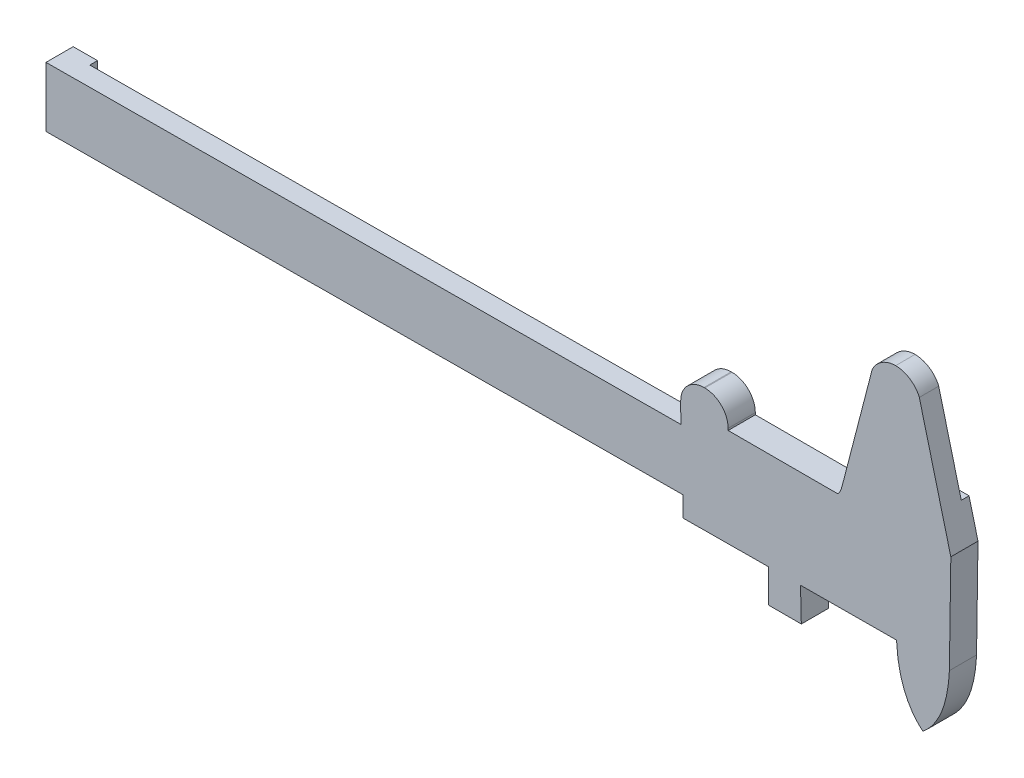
SolidWorks part; units mm, degrees
ref_plane "Front" through (0, 0, 0) normal (0, 0, 1) x (1, 0, 0)
ref_plane "Top" through (0, 0, 0) normal (0, 1, 0) x (1, 0, 0)
ref_plane "Right" through (0, 0, 0) normal (1, 0, 0) x (0, 0, -1)
sketch "Esquisse1" plane through (0, 0, 0) normal (0, 0, 1) x (1, 0, 0)
  line L0 (56.9792, 37.5298) -> (218.1204, -15.4507) construction
  line L1 (0, 0) -> (297.3533, 0) construction
  line L2 (228.6397, 13.6425) -> (203.9081, 13.5241)
  line L3 (204.1175, 4.9655) -> (203.9081, 13.5241)
  line L4 (195.6262, 13.5156) -> (173.6397, 13.3669)
  line L5 (173.6397, 13.3669) -> (173.6397, 18.5659)
  line L6 (173.6397, 18.5659) -> (9.5377, 17.5648)
  line L7 (9.5377, 17.5648) -> (9.5377, 32.987)
  line L8 (9.5377, 32.987) -> (173.0748, 33.9846)
  line L9 (173.0748, 33.9846) -> (173.0064, 45.204)
  line L10 (173.0064, 45.204) -> (185.2667, 45.204)
  line L11 (185.2667, 45.204) -> (185.2667, 38.7229)
  line L12 (185.2667, 38.7229) -> (213.4789, 38.7229)
  line L13 (222.3354, 70.7304) -> (214.6774, 41.1858)
  line L14 (234.5151, 70.7304) -> (242.6343, 39.222)
  line L15 (242.6343, 39.222) -> (242.2593, 13.6425)
  line L16 (195.6262, 13.5156) -> (195.684, 4.9655)
  line L17 (195.684, 4.9655) -> (204.1175, 4.9655)
  line L18 (235.4495, 0.7286) -> (235.4495, 10.8165) construction
  line L19 (228.4253, 47.123) -> (228.4253, 63.9571) construction
  spline S0 degree 3 poles (228.6397, 13.6425) (228.9453, 7.5007) (230.4483, 0.8489) (235.4495, -3.3066) knots 0 0 0 0 1 1 1 1
  spline S1 degree 3 poles (242.2593, 13.6425) (241.9537, 7.5007) (240.4508, 0.8489) (235.4495, -3.3066) knots 0 0 0 0 1 1 1 1
  spline S2 degree 3 poles (222.3354, 70.7304) (223.2655, 73.1065) (225.8348, 74.7747) (228.4253, 74.7747) knots 0 0 0 0 1 1 1 1
  spline S3 degree 3 poles (234.5151, 70.7304) (233.5851, 73.1065) (231.0157, 74.7747) (228.4253, 74.7747) knots 0 0 0 0 1 1 1 1
  spline S4 degree 3 poles (213.4789, 38.7229) (214.2306, 39.406) (214.4393, 40.2671) (214.6774, 41.1858) knots 0 0 0 0 1 1 1 1
  point P20 (9.5377, 32.0225)
  dimension "D1" = 55
extrude "Boss.-Extru.1" add sketch "Esquisse1" along normal blind 7
fillet "Congé1" radius 6 2 edges at (173.0064, 45.204, 3.5) (185.2667, 45.204, 3.5)
sketch "Esquisse2" plane through (0, 0, 0) normal (0, 0, -1) x (-1, 0, 0)
  line L0 (-173.6397, 18.5659) -> (-173.0748, 33.9846)
  line L1 (-173.0748, 33.9846) -> (-15.8212, 33.0253)
  line L2 (-173.0748, 33.9846) -> (-9.5377, 32.987) construction
  line L3 (-15.8212, 33.0253) -> (-15.8212, 17.6032)
  line L4 (-9.5377, 17.5648) -> (-173.6397, 18.5659) construction
  line L5 (-15.8212, 17.6032) -> (-173.6397, 18.5659)
extrude "Enlèv. mat.-Extru.1" cut sketch "Esquisse2" against normal blind 2
sketch "Esquisse3" plane through (0, 0, 0) normal (0, 0, -1) x (-1, 0, 0)
  line L0 (-222.3354, 70.7304) -> (-214.6774, 41.1858) construction
  line L1 (-242.6343, 39.222) -> (-234.5151, 70.7304) construction
  line L2 (-222.3354, 70.7304) -> (-216.4912, 48.1835)
  line L3 (-240.3251, 48.1835) -> (-234.5151, 70.7304)
  line L4 (-240.3251, 48.1835) -> (-216.4912, 48.1835)
  spline S0 degree 3 poles (1990.7209, -1934.1177) (-2748.921, 1801.3548) (2500.9731, -1312.7001) (-3047.9717, 1059.1673) knots -11.267498 -11.267498 -11.267498 -11.267498 12.153158 12.153158 12.153158 12.153158 only from (-228.4253, 74.7747) to (-222.3354, 70.7304) construction
  spline S1 degree 3 poles (2591.2079, 1059.2044) (-2957.8743, -1312.7309) (2292.0875, 1801.3698) (-2447.5611, -1934.1095) knots -11.15328 -11.15328 -11.15328 -11.15328 12.267481 12.267481 12.267481 12.267481 only from (-234.5151, 70.7304) to (-228.4253, 74.7747) construction
  spline S2 degree 3 poles (-228.4253, 74.7747) (-225.8348, 74.7747) (-223.2655, 73.1065) (-222.3354, 70.7304) knots 0 0 0 0 1 1 1 1
  spline S3 degree 3 poles (-234.5151, 70.7304) (-233.5851, 73.1065) (-231.0157, 74.7747) (-228.4253, 74.7747) knots 0 0 0 0 1 1 1 1
extrude "Enlèv. mat.-Extru.2" cut sketch "Esquisse3" against normal blind 2
